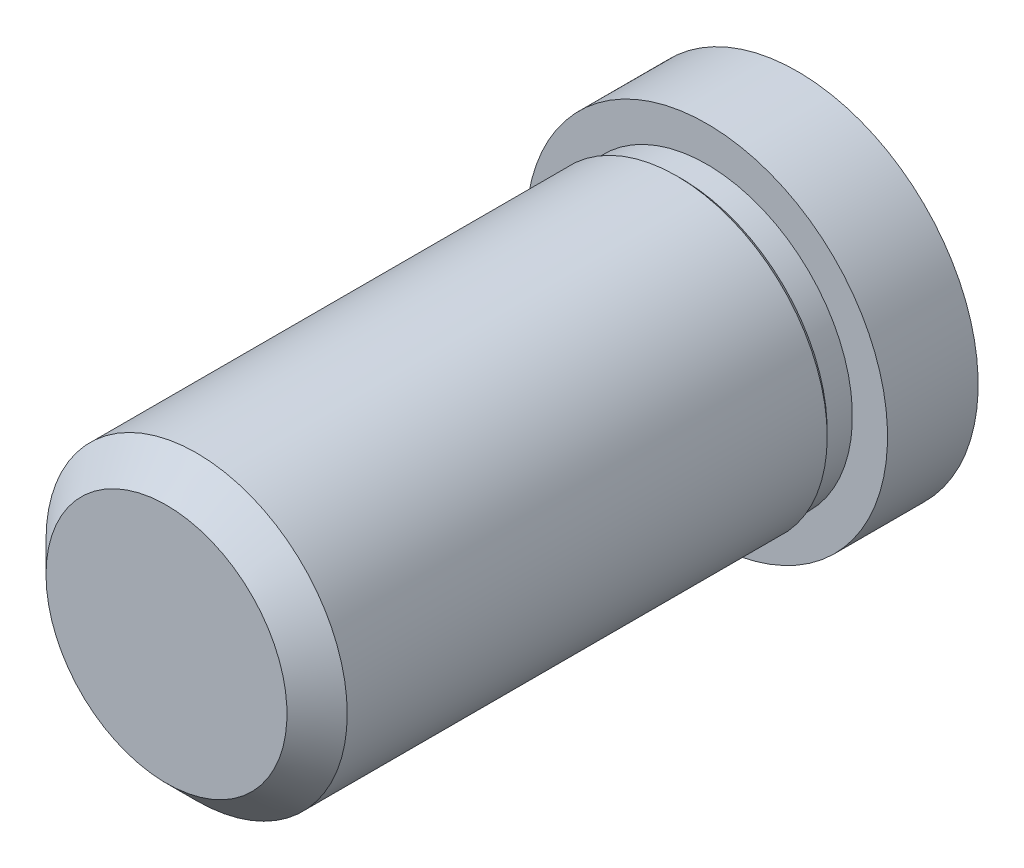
SolidWorks part; units mm, degrees
ref_plane "Front" through (0, 0, 0) normal (0, 0, 1) x (1, 0, 0)
ref_plane "Top" through (0, 0, 0) normal (0, 1, 0) x (1, 0, 0)
ref_plane "Right" through (0, 0, 0) normal (1, 0, 0) x (0, 0, -1)
sketch "Logo3_Revol_Axis" plane through (0, 0, 0) normal (0, 1, 0) x (1, 0, 0)
  line L0 (0, -30.1653) -> (0, 30.1653) construction
sketch "Logo3_bib1" plane through (0, 0, 0) normal (0, -1, 0) x (-1, 0, 0)
  line L1 (5.08, -28.4747) -> (7.9375, -28.4747)
  line L2 (7.9375, -28.4747) -> (7.9375, -1.5917)
  line L4 (7.6729, 0) -> (7.6729, -1.3271)
  line L5 (7.6729, 0) -> (9.525, 0)
  line L6 (9.525, 0) -> (9.525, 4.7752)
  line L7 (5.2246, 4.7752) -> (5.08, -25.2997)
  line L8 (5.08, -25.2997) -> (5.08, -28.4747)
  line L9 (9.525, 4.7752) -> (5.2246, 4.7752)
  line L10 (0, 19.4323) -> (0, -23.9633) construction
  line L11 (7.9375, -1.5917) -> (7.6729, -1.3271)
  point P11 (5.2246, 4.7752)
revolve "Revolve1" add sketch "Logo3_bib1" angle 360 about L10
other "DeleteFace1"
chamfer "Chamfer1" distance 1.5875 angle 45 1 edges at (-7.9375, 0, 28.4747)
equation "\"prof_rainure@Logo3_bib1\" = (\"logo3_d4@Logo3_bib1\"-\"logo3_d3@Logo3_bib1\")/12"
